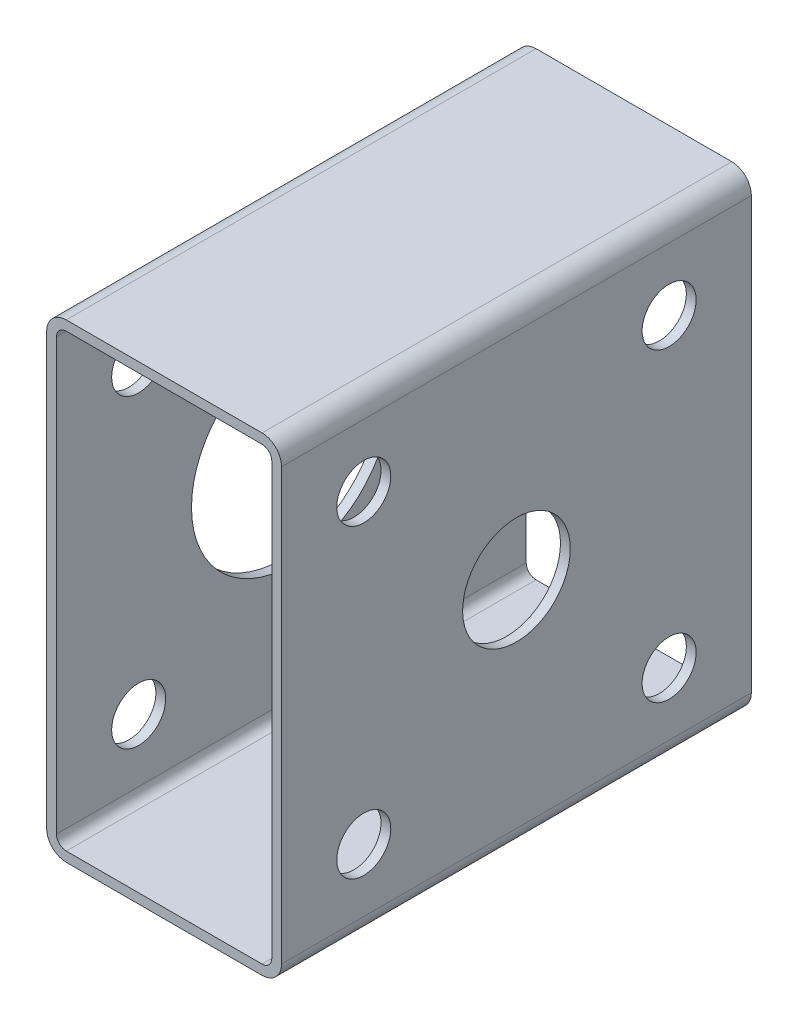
SolidWorks part; units mm, degrees
ref_plane "Plane1" through (0, 0, 0) normal (0, 0, 1) x (1, 0, 0)
ref_plane "Plane2" through (0, 0, 0) normal (0, 1, 0) x (1, 0, 0)
ref_plane "Plane3" through (0, 0, 0) normal (1, 0, 0) x (0, 0, -1)
sketch "Sketch1" plane through (0, 0, 0) normal (0, 0, 1) x (1, 0, 0)
  line L0 (-34.925, -69.85) -> (-34.925, 69.85)
  line L1 (-31.75, -76.2) -> (31.75, -76.2)
  line L2 (-38.1, -69.85) -> (-38.1, 69.85)
  line L3 (-31.75, 76.2) -> (31.75, 76.2)
  line L4 (38.1, -69.85) -> (38.1, 69.85)
  line L5 (-31.75, 73.025) -> (31.75, 73.025)
  line L6 (34.925, -69.85) -> (34.925, 69.85)
  line L7 (-31.75, -73.025) -> (31.75, -73.025)
  arc A0 (-31.75, 73.025) -> (-34.925, 69.85) centre (-31.75, 69.85) ccw
  arc A1 (34.925, 69.85) -> (31.75, 73.025) centre (31.75, 69.85) ccw
  arc A2 (34.925, -69.85) -> (31.75, -73.025) centre (31.75, -69.85) cw
  arc A3 (-34.925, -69.85) -> (-31.75, -73.025) centre (-31.75, -69.85) ccw
  arc A4 (-38.1, -69.85) -> (-31.75, -76.2) centre (-31.75, -69.85) ccw
  arc A5 (38.1, -69.85) -> (31.75, -76.2) centre (31.75, -69.85) cw
  arc A6 (38.1, 69.85) -> (31.75, 76.2) centre (31.75, 69.85) ccw
  arc A7 (-31.75, 76.2) -> (-38.1, 69.85) centre (-31.75, 69.85) ccw
  dimension "D1" = 3.175
  dimension "D2" = 6.35
  dimension "D3" = 76.2
  dimension "D4" = 152.4
extrude "3 X 6 CHANNEL" add sketch "Sketch1" along normal blind 152.4
sketch "Sketch2" plane through (38.1, 0, 0) normal (1, 0, 0) x (0, 0, -1)
  line L0 (-76.2, 76.2) -> (-76.2, -76.2) construction
  line L1 (-152.4, 76.2) -> (0, 76.2) construction
  line L2 (-152.4, -76.2) -> (0, -76.2) construction
  line L3 (-152.4, 0) -> (0, 0) construction
  line L4 (-152.4, -69.85) -> (-152.4, 69.85) construction
  circle A0 centre (-76.2, 0) radius 17.4625
  circle A1 centre (-125.73, 49.53) radius 8.763
  circle A2 centre (-26.67, 49.53) radius 8.763
  circle A3 centre (-26.67, -49.53) radius 8.763
  circle A4 centre (-125.73, -49.53) radius 8.763
  dimension "D1" = 49.53
  dimension "D2" = 49.53
extrude "(1) 1.375  (4) .69 HOLES " cut sketch "Sketch2" against normal up to next
sketch "Sketch4" plane through (-38.1, 0, 0) normal (-1, 0, 0) x (0, 0, 1)
  line L0 (76.2, 76.2) -> (76.2, -76.2) construction
  line L1 (152.4, 76.2) -> (0, 76.2) construction
  line L2 (152.4, -76.2) -> (0, -76.2) construction
  circle A0 centre (76.2, 0) radius 32.385
  circle A1 centre (26.67, 49.53) radius 8.763
  circle A2 centre (125.73, 49.53) radius 8.763
  circle A3 centre (26.67, -49.53) radius 8.763
  circle A4 centre (125.73, -49.53) radius 8.763
extrude "(1) 2.55  (4) .69 HOLES" cut sketch "Sketch4" against normal up to next
